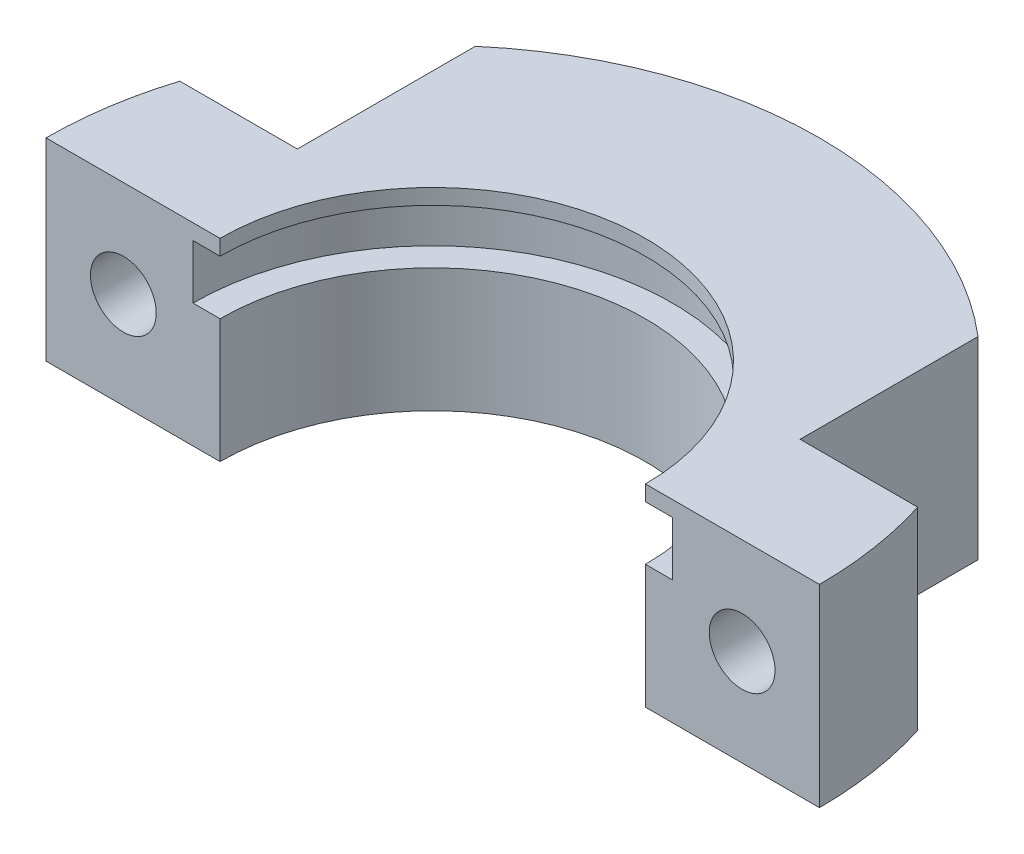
SolidWorks part; units mm, degrees
ref_plane "Спереди" through (0, 0, 0) normal (0, 0, 1) x (1, 0, 0)
ref_plane "Сверху" through (0, 0, 0) normal (0, 1, 0) x (1, 0, 0)
ref_plane "Справа" through (0, 0, 0) normal (1, 0, 0) x (0, 0, -1)
sketch "Sketch1" plane through (0, 0, 0) normal (0, 1, 0) x (1, 0, 0)
  line L0 (0, 128.9521) -> (0, -130.4287) construction
  line L1 (139.288, 0) -> (-139.288, 0) construction
  line L2 (100, 0) -> (-100, 0)
  arc A0 (55, 0) -> (-55, 0) centre (0, 0) ccw
  arc A1 (100, 0) -> (-100, 0) centre (0, 0) ccw
  dimension "D1" = 200
  dimension "D2" = 110
extrude "Extrude1" add sketch "Sketch1" along normal blind 50 contours L2 A1 A0
sketch "Sketch2" plane through (0, 0, 0) normal (1, 0, 0) x (0, 0, -1)
  line L0 (0, 0) -> (100, 0) construction
  line L1 (31.9145, 46) -> (62, 46)
  line L2 (31.9145, 46) -> (31.9145, 32)
  line L3 (31.9145, 32) -> (62, 32)
  line L4 (62, 46) -> (62, 32)
  line L5 (0, 71.2707) -> (0, -40.2957) construction
  dimension "D1" = 32
  dimension "D2" = 14
  dimension "D3" = 124
revolve "Cut-Revolve1" cut sketch "Sketch2" angle 360 about L5
sketch "Sketch3" plane through (0, 50, 0) normal (0, 1, 0) x (1, 0, 0)
  line L0 (0, 130.6409) -> (0, -59.2176) construction
  line L1 (65, 102.8117) -> (65, 30)
  line L2 (65, 30) -> (108.0432, 30)
  line L3 (108.0432, 30) -> (108.0432, 102.8117)
  line L4 (108.0432, 102.8117) -> (65, 102.8117)
  line L5 (100, 0) -> (55, 0) construction
  dimension "D1" = 30
  dimension "D2" = 130
extrude "Cut-Extrude1" cut sketch "Sketch3" against normal up to next
mirror "Mirror1" about plane through (0, 0, 0) normal (1, 0, 0) of "Cut-Extrude1"
sketch "Sketch4" plane through (0, 0, -30) normal (0, 0, -1) x (-1, 0, 0)
  line L0 (132.7704, 25) -> (-121.6791, 25) construction
  line L1 (95.3939, 0) -> (65, 0) construction
  line L2 (0, 83.7191) -> (0, -39.9172) construction
  circle A0 centre (80, 25) radius 8.5
  circle A1 centre (-80, 25) radius 8.5
  dimension "D2" = 160
  dimension "D3" = 17
  dimension "D1" = 25
extrude "Cut-Extrude2" cut sketch "Sketch4" against normal up to next
